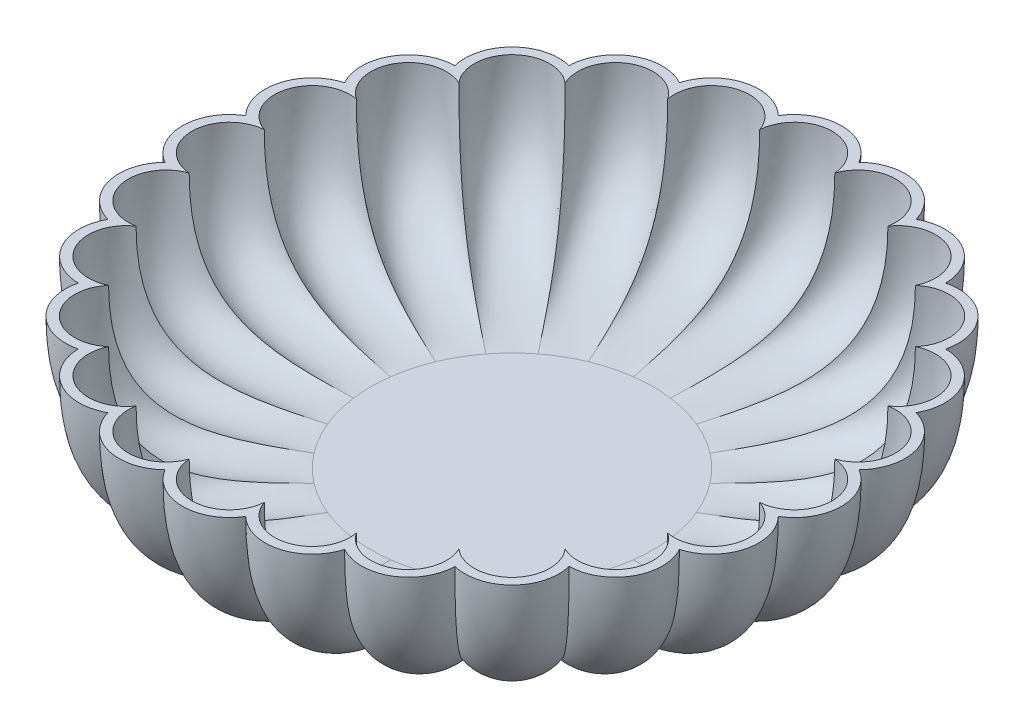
SolidWorks part; units mm, degrees
ref_plane "Front Plane" through (0, 0, 0) normal (0, 0, 1) x (1, 0, 0)
ref_plane "Top Plane" through (0, 0, 0) normal (0, 1, 0) x (1, 0, 0)
ref_plane "Right Plane" through (0, 0, 0) normal (1, 0, 0) x (0, 0, -1)
ref_plane "Plane1" through (0, 70, 0) normal (0, 1, 0) x (1, 0, 0)
sketch "Sketch1" plane through (0, 70, 0) normal (0, 1, 0) x (1, 0, 0)
  arc A1 (58.4737, 141.1679) -> (19.9443, 151.4919) centre (38.8229, 144.8889) ccw
  arc A2 (93.0182, 121.2237) -> (58.4737, 141.1679) centre (75, 129.9038) ccw
  arc A3 (121.2237, 93.0182) -> (93.0182, 121.2237) centre (106.066, 106.066) ccw
  arc A4 (141.1679, 58.4737) -> (121.2237, 93.0182) centre (129.9038, 75) ccw
  arc A7 (151.4919, 19.9443) -> (141.1679, 58.4737) centre (144.8889, 38.8229) ccw
  arc A8 (151.4919, -19.9443) -> (151.4919, 19.9443) centre (150, 0) ccw
  arc A10 (141.1679, -58.4737) -> (151.4919, -19.9443) centre (144.8889, -38.8229) ccw
  arc A11 (121.2237, -93.0182) -> (141.1679, -58.4737) centre (129.9038, -75) ccw
  arc A13 (93.0182, -121.2237) -> (121.2237, -93.0182) centre (106.066, -106.066) ccw
  arc A14 (58.4737, -141.1679) -> (93.0182, -121.2237) centre (75, -129.9038) ccw
  arc A16 (19.9443, -151.4919) -> (58.4737, -141.1679) centre (38.8229, -144.8889) ccw
  arc A17 (-19.9443, -151.4919) -> (19.9443, -151.4919) centre (0, -150) ccw
  arc A19 (-58.4737, -141.1679) -> (-19.9443, -151.4919) centre (-38.8229, -144.8889) ccw
  arc A20 (-93.0182, -121.2237) -> (-58.4737, -141.1679) centre (-75, -129.9038) ccw
  arc A22 (-121.2237, -93.0182) -> (-93.0182, -121.2237) centre (-106.066, -106.066) ccw
  arc A23 (-141.1679, -58.4737) -> (-121.2237, -93.0182) centre (-129.9038, -75) ccw
  arc A25 (-151.4919, -19.9443) -> (-141.1679, -58.4737) centre (-144.8889, -38.8229) ccw
  arc A26 (-151.4919, 19.9443) -> (-151.4919, -19.9443) centre (-150, 0) ccw
  arc A28 (-141.1679, 58.4737) -> (-151.4919, 19.9443) centre (-144.8889, 38.8229) ccw
  arc A29 (-121.2237, 93.0182) -> (-141.1679, 58.4737) centre (-129.9038, 75) ccw
  arc A31 (-93.0182, 121.2237) -> (-121.2237, 93.0182) centre (-106.066, 106.066) ccw
  arc A32 (-58.4737, 141.1679) -> (-93.0182, 121.2237) centre (-75, 129.9038) ccw
  arc A34 (-19.9443, 151.4919) -> (-58.4737, 141.1679) centre (-38.8229, 144.8889) ccw
  arc A35 (19.9443, 151.4919) -> (-19.9443, 151.4919) centre (0, 150) ccw
  point P77 (0, 0)
  dimension "D1" = 12
sketch "Sketch2" plane through (0, 0, 0) normal (0, 1, 0) x (1, 0, 0)
  circle A0 centre (0, 0) radius 75
loft "Loft1" add profiles "Sketch1", "Sketch2"
shell "Shell2" thickness 5
